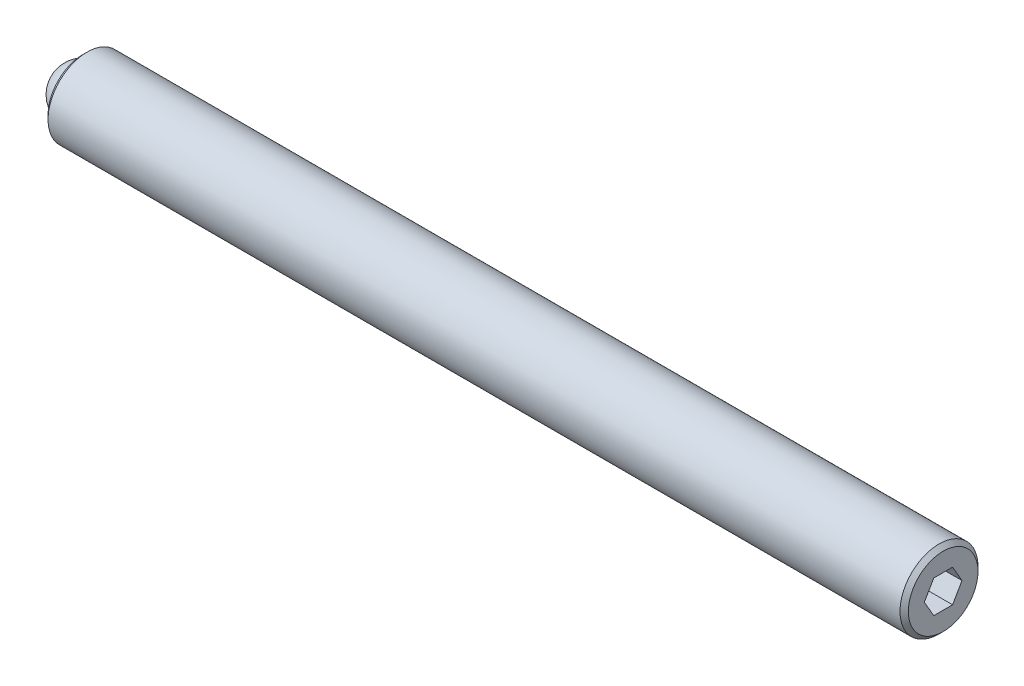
SolidWorks part; units mm, degrees
ref_plane "Front Plane" through (0, 0, 0) normal (0, 0, 1) x (1, 0, 0)
ref_plane "Top Plane" through (0, 0, 0) normal (0, 1, 0) x (1, 0, 0)
ref_plane "Right Plane" through (0, 0, 0) normal (1, 0, 0) x (0, 0, -1)
sketch "Sketch2" plane through (0, 0, 0) normal (1, 0, 0) x (0, 0, -1)
  circle A0 centre (0, 0) radius 2.3749
  dimension "D1" = 4.7498
extrude "Boss-Extrude1" add sketch "Sketch2" along normal blind 52.3875
sketch "Sketch3" plane through (0, 0, 0) normal (-1, 0, 0) x (0, 0, 1)
  circle A0 centre (0, 0) radius 1.5875
  dimension "D1" = 3.175
chamfer "Chamfer1" distance 0.254 angle 45 1 edges at (0, 0, -2.3749)
chamfer "Chamfer2" distance 0.254 angle 45 1 edges at (52.3875, 0, -2.3749)
sketch "Sketch4" plane through (52.3875, 0, 0) normal (1, 0, 0) x (0, 0, -1)
  line L1 (1.1457, 0) -> (0.5728, 0.9922)
  line L2 (0.5728, 0.9922) -> (-0.5728, 0.9922)
  line L3 (-0.5728, 0.9922) -> (-1.1457, 0)
  line L4 (-1.1457, 0) -> (-0.5728, -0.9922)
  line L5 (-0.5728, -0.9922) -> (0.5728, -0.9922)
  line L6 (0.5728, -0.9922) -> (1.1457, 0)
  circle A0 centre (0, 0) radius 0.9922 construction
extrude "Cut-Extrude2" cut sketch "Sketch4" against normal blind 2.286
extrude "Cut-Extrude3" cut sketch "Sketch3" against normal blind 1.5875
sketch "Sketch5" plane through (0, 0, 0) normal (-1, 0, 0) x (0, 0, 1)
  line L0 (0, 0) -> (0, -1.5875)
  line L1 (0, 0) -> (0, 1.5875)
  arc A0 (0, 1.5875) -> (0, -1.5875) centre (0, 0) ccw
revolve "Revolve1" add sketch "Sketch5" angle 360 about L1
